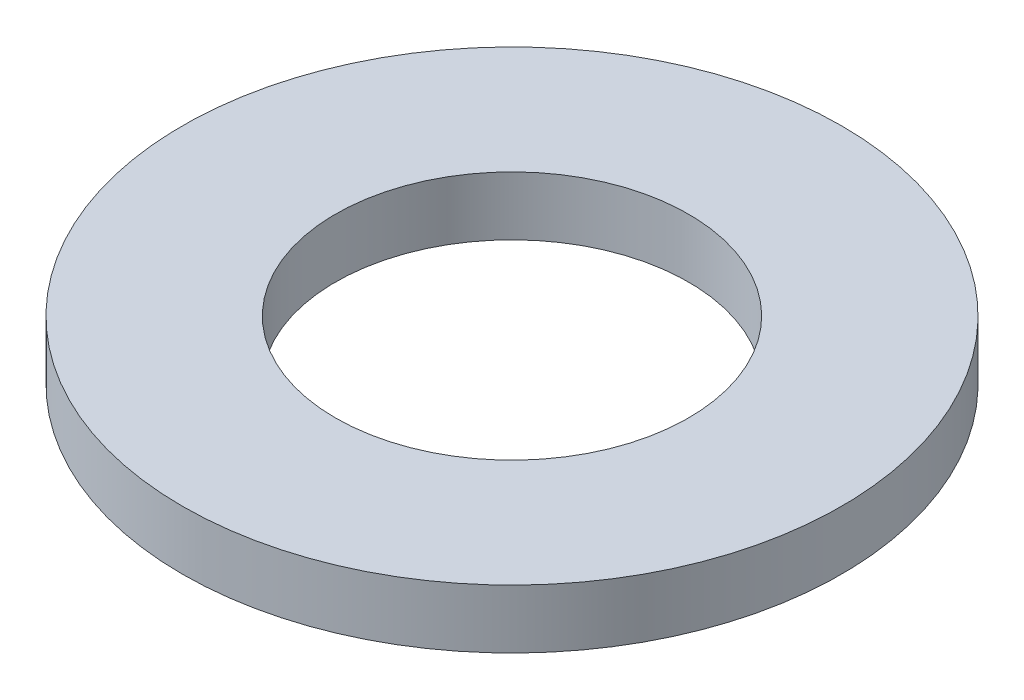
SolidWorks part; units mm, degrees
ref_plane "Front" through (0, 0, 0) normal (0, 0, 1) x (1, 0, 0)
ref_plane "Top" through (0, 0, 0) normal (0, 1, 0) x (1, 0, 0)
ref_plane "Right" through (0, 0, 0) normal (1, 0, 0) x (0, 0, -1)
sketch "Sketch1" plane through (0, 0, 0) normal (0, 1, 0) x (1, 0, 0)
  circle A0 centre (0, 0) radius 7.5
  circle A1 centre (0, 0) radius 14
extrude "Extrude1" add sketch "Sketch1" along normal blind 2.5
